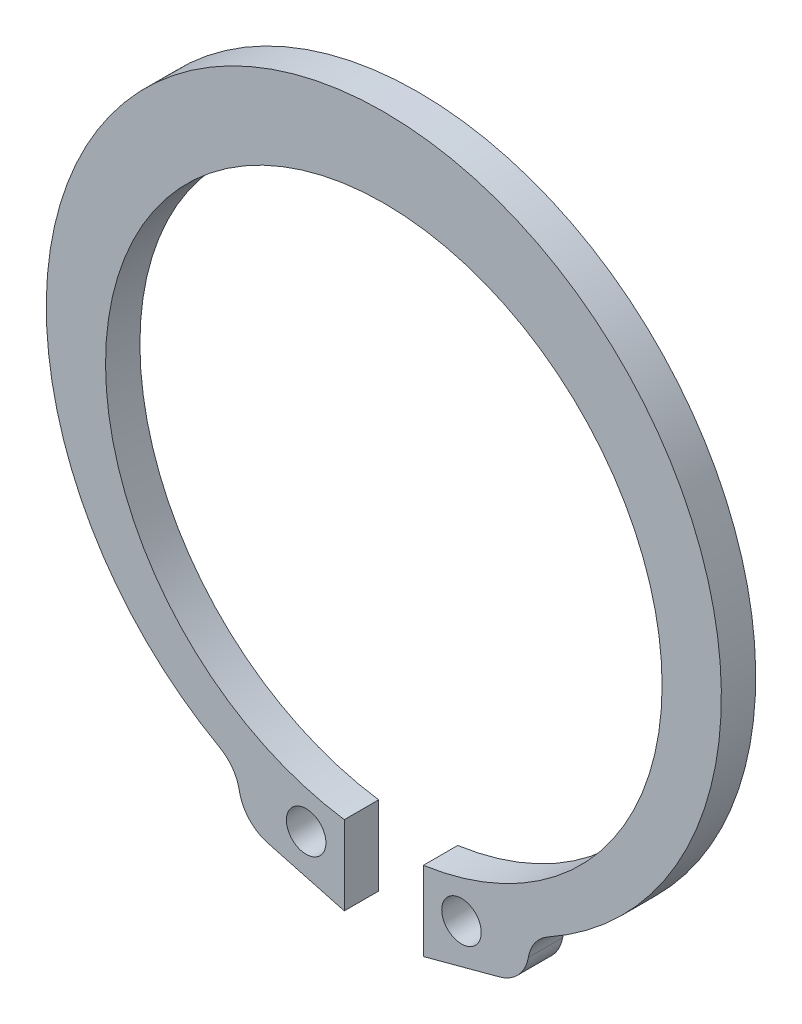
SolidWorks part; units mm, degrees
ref_plane "Plan1" through (0, 0, 0) normal (0, 0, 1) x (1, 0, 0)
ref_plane "Plan2" through (0, 0, 0) normal (0, 1, 0) x (1, 0, 0)
ref_plane "Plan3" through (0, 0, 0) normal (1, 0, 0) x (0, 0, -1)
sketch "Esquisse1" plane through (0, 0, 0) normal (0, 0, 1) x (1, 0, 0)
  line L0 (0, 6.6) -> (0, -5.8132) construction
  line L1 (-1.15, -8.0179) -> (-1.15, -10.3179)
  line L2 (-1.15, -10.3179) -> (-3.3716, -9.7227)
  line L3 (-1.15, -8.0179) -> (-3.3716, -9.7227) construction
  line L4 (1.15, -10.3179) -> (3.3716, -9.7227)
  line L5 (1.15, -8.0179) -> (1.15, -10.3179)
  arc A0 (1.15, -8.0179) -> (-1.15, -8.0179) centre (0, 0) ccw
  arc A1 (4.7791, -8.0093) -> (-4.7791, -8.0093) centre (0, 0.575) ccw
  arc A2 (-4.2063, -8.813) -> (-4.7791, -8.0093) centre (-5.3385, -9.0141) ccw
  arc A3 (-4.2063, -8.813) -> (-3.3716, -9.7227) centre (-3.074, -8.6119) ccw
  arc A4 (4.2063, -8.813) -> (4.7791, -8.0093) centre (5.3385, -9.0141) cw
  circle A5 centre (-2.2608, -8.8703) radius 0.575
  circle A6 centre (2.2608, -8.8703) radius 0.575
  arc A8 (4.2063, -8.813) -> (3.3716, -9.7227) centre (3.074, -8.6119) cw
  dimension "D1" = 1.15
  dimension "Diamètre de gorge" = 16.2
  dimension "D2" = 12.4132
  dimension "D7" = 1.15
  dimension "D8" = 1.15
  dimension "D4" = 9.825
  dimension "D3" = 0.575
  dimension "Décalage" = 2.3
  dimension "D5" = 1.15
  dimension "D6" = 75
extrude "Base-Extrusion" add sketch "Esquisse1" along normal blind 1
equation "\"D3@Esquisse1\" = \"Décalage@Esquisse1\"/4"
equation "\"D5@Esquisse1\" = \"Décalage@Esquisse1\"/2"
equation "\"D8@Esquisse1\" = \"D5@Esquisse1\""
equation "\"D7@Esquisse1\" = \"D5@Esquisse1\""
equation "\"D4@Esquisse1\" = (\"Diamètre de gorge@Esquisse1\"+((\"Décalage@Esquisse1\"/2)*3))/2"
equation "\"D1@Esquisse1\" = \"D7@Esquisse1\""
